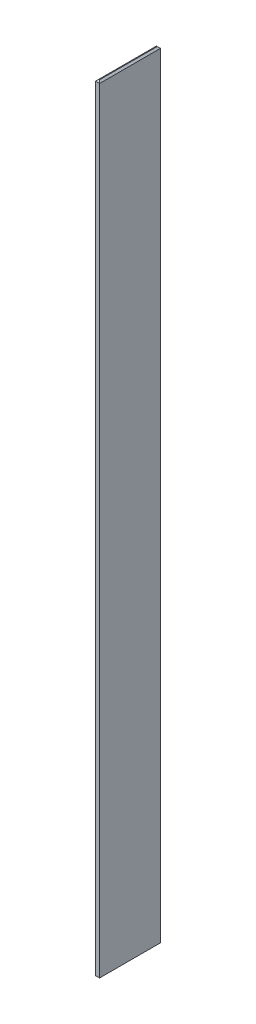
SolidWorks part; units mm, degrees
ref_plane "Front Plane" through (0, 0, 0) normal (1, 0, 0) x (0, 1, 0)
ref_plane "Top Plane" through (0, 0, 0) normal (0, 0, 1) x (0, 1, 0)
ref_plane "Right Plane" through (0, 0, 0) normal (0, 1, 0) x (-1, 0, 0)
sketch "Sketch1" plane through (0, 0, 0) normal (0, 1, 0) x (-1, 0, 0)
  line L1 (-25.4, 381) -> (25.4, 381)
  line L2 (-25.4, 381) -> (-25.4, -381)
  line L3 (-25.4, -381) -> (25.4, -381)
  line L4 (25.4, 381) -> (25.4, -381)
  line L5 (-25.4, 381) -> (25.4, -381) construction
  line L6 (-25.4, -381) -> (25.4, 381) construction
  point P0 (0, 0)
  dimension "D1" = 762
  dimension "D2" = 50.8
extrude "Boss-Extrude1" add sketch "Sketch1" along normal blind 9739.6
ref_plane "Mating plane" through (0, 0, -631) normal (0, 0, -1) x (0, 1, 0)
chamfer "Chamfer1" distance 20 angle 45 8 edges at (0, 0, 381) (25.4, 0, 0) (0, 0, -381) (-25.4, 0, 0) (0, 9739.6, -381) (25.4, 9739.6, 0) (0, 9739.6, 381) (-25.4, 9739.6, 0)
